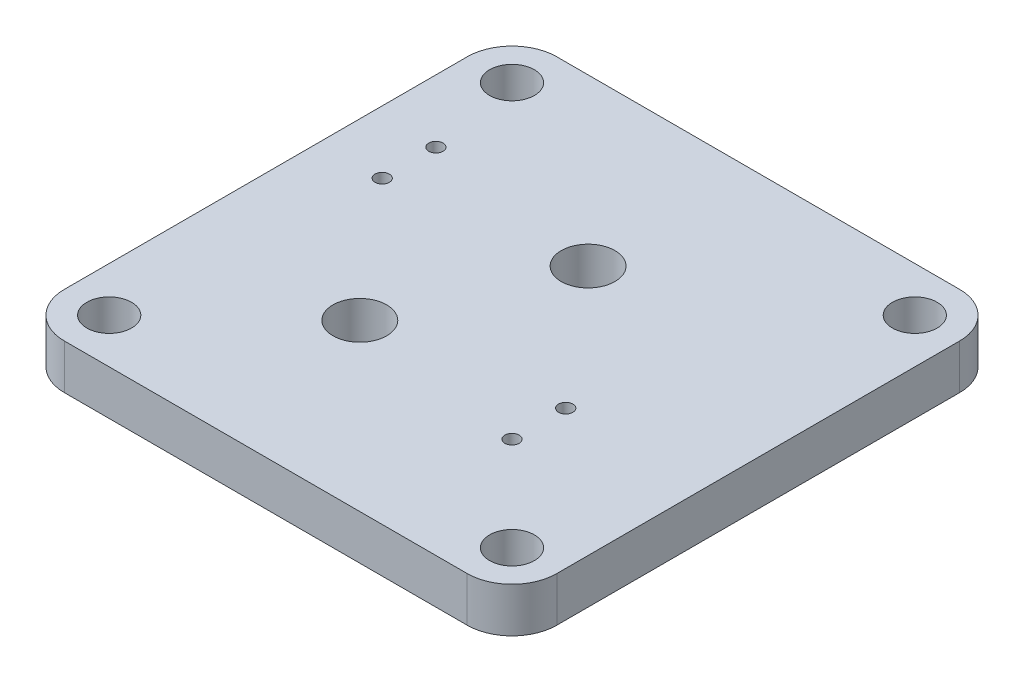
SolidWorks part; units mm, degrees
ref_plane "face" through (0, 0, 0) normal (0, 0, 1) x (1, 0, 0)
ref_plane "dessus" through (0, 0, 0) normal (0, 1, 0) x (1, 0, 0)
ref_plane "profil" through (0, 0, 0) normal (1, 0, 0) x (0, 0, -1)
sketch "Esquisse1" plane through (0, 0, 0) normal (0, 1, 0) x (1, 0, 0)
  line L1 (-27.5, 27.5) -> (27.5, 27.5)
  line L2 (-27.5, 27.5) -> (-27.5, -27.5)
  line L3 (-27.5, -27.5) -> (27.5, -27.5)
  line L4 (27.5, 27.5) -> (27.5, -27.5)
  dimension "D1" = 55
  dimension "D2" = 55
  dimension "D3" = 27.5
  dimension "D4" = 27.5
extrude "Base-Extrusion" add sketch "Esquisse1" along normal blind 5
fillet "Congé1" radius 5
sketch "Esquisse2" plane through (0, 5, 0) normal (0, 1, 0) x (-1, 0, 0)
  line L0 (0, -29.7407) -> (0, 30.6574) construction
  line L1 (34.4259, 0) -> (-35.5463, 0) construction
  circle A0 centre (22.5, -22.5) radius 2.5
  arc A1 (22.5, -27.5) -> (27.5, -22.5) centre (22.5, -22.5) ccw construction
  circle A2 centre (-22.5, -22.5) radius 2.5
  circle A3 centre (-22.5, 22.5) radius 2.5
  circle A4 centre (22.5, 22.5) radius 2.5
  dimension "D1" = 5
extrude "Enlèv. mat.-Extru.1" cut sketch "Esquisse2" against normal through all
sketch "Esquisse3" plane through (0, 5, 0) normal (0, 1, 0) x (-1, 0, 0)
  line L0 (0.5, -9) -> (25.7821, -9) construction
  line L1 (13.8804, 9) -> (-25.0617, 9) construction
  circle A0 centre (8, 9) radius 3
  circle A1 centre (0.5, -9) radius 3
  circle A2 centre (20.5, -12) radius 0.8
  circle A3 centre (20.5, -6) radius 0.8
  circle A4 centre (-12, 6) radius 0.8
  circle A5 centre (-12, 12) radius 0.8
  dimension "D1" = 6
  dimension "D3" = 12
  dimension "D4" = 6
  dimension "D6" = 20.5
  dimension "D8" = 1.6
  dimension "D9" = 20
  dimension "D10" = 1.6
  dimension "D11" = 20
  dimension "D12" = 3
  dimension "D2" = 9
  dimension "D5" = 9
  dimension "D7" = 3
extrude "Enlèv. mat.-Extru.2" cut sketch "Esquisse3" against normal through all
